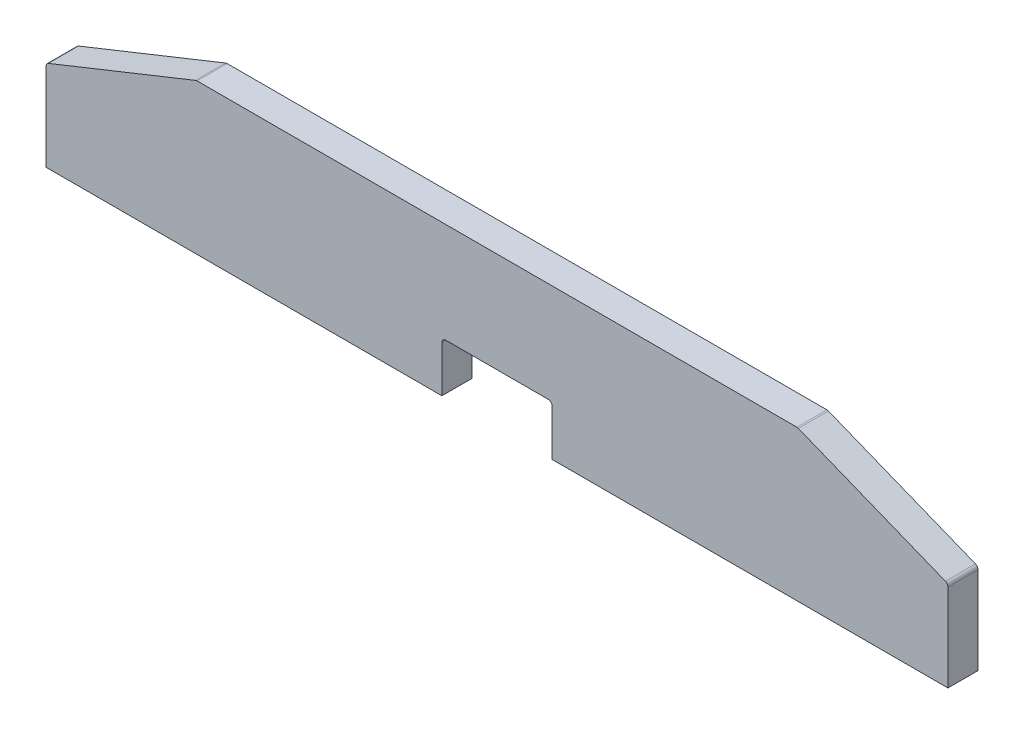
SolidWorks part; units mm, degrees
ref_plane "Piano frontale" through (0, 0, 0) normal (0, 0, 1) x (1, 0, 0)
ref_plane "Piano superiore" through (0, 0, 0) normal (0, 1, 0) x (1, 0, 0)
ref_plane "Piano destro" through (0, 0, 0) normal (1, 0, 0) x (0, 0, -1)
sketch "Schizzo1" plane through (0, 0, 0) normal (0, 0, 1) x (1, 0, 0)
  line L1 (-450, -50) -> (-55, -50)
  line L2 (-450, -50) -> (-450, 40)
  line L3 (-300, 100) -> (300, 100)
  line L4 (450, -50) -> (450, 40)
  line L7 (-450, -50) -> (-450, 40) construction
  line L8 (-450, 40) -> (-300, 100) construction
  line L9 (-450, 40) -> (-300, 100)
  line L10 (300, 100) -> (450, 40)
  line L12 (-55, -50) -> (-55, 0) construction
  line L13 (-55, 0) -> (55, 0) construction
  line L14 (-55, -50) -> (-55, 0)
  line L15 (-55, 0) -> (55, 0)
  line L16 (55, 0) -> (55, -50)
  line L17 (55, -50) -> (450, -50)
  point P0 (0, -50)
  dimension "D1" = 55
  dimension "D2" = 300
  dimension "D3" = 450
  dimension "D4" = 55
  dimension "D5" = 40
  dimension "D6" = 100
  dimension "D7" = 50
extrude "Estrusione-Estrusione1" add sketch "Schizzo1" along normal blind 30
fillet "Raccordo1" radius 4 1 edges at (55, 0, 15)
fillet "Raccordo2" radius 4 1 edges at (-55, 0, 15)
fillet "Raccordo3" radius 4 1 edges at (300, 100, 15)
fillet "Raccordo4" radius 4 1 edges at (450, 40, 15)
fillet "Raccordo5" radius 4 1 edges at (-300, 100, 15)
fillet "Raccordo6" radius 4 1 edges at (-450, 40, 15)
sketch "Sketch1" plane through (0, 0, 0) normal (0, 0, 1) x (1, 0, 0)
  line L0 (0, -10) -> (-300, -10) construction
  line L1 (-300, 52) -> (-300, 72)
  line L2 (-300, 72) -> (-280, 72)
  line L3 (-280, 72) -> (-280, 52)
  line L4 (-280, 52) -> (-300, 52)
  line L5 (-300, 10) -> (-300, -10)
  line L6 (-300, -10) -> (-280, -10)
  line L7 (-280, -10) -> (-280, 10)
  line L8 (-125, 52) -> (-125, 72)
  line L9 (280, 10) -> (300, 10)
  line L10 (105, 10) -> (125, 10)
  line L11 (105, -10) -> (105, 10)
  line L12 (125, -10) -> (105, -10)
  line L13 (125, 10) -> (125, -10)
  line L14 (105, 52) -> (125, 52)
  line L15 (105, 72) -> (105, 52)
  line L16 (125, 72) -> (105, 72)
  line L17 (125, 52) -> (125, 72)
  line L18 (0, 100) -> (0, -50) construction
  line L19 (280, -10) -> (280, 10)
  line L20 (0, -10) -> (300, -10) construction
  line L21 (-299.4129, 52) -> (299.4129, 52) construction
  line L22 (-125, 72) -> (-105, 72)
  line L23 (-105, 72) -> (-105, 52)
  line L24 (-105, 52) -> (-125, 52)
  line L25 (-125, 10) -> (-125, -10)
  line L26 (-125, -10) -> (-105, -10)
  line L27 (-105, -10) -> (-105, 10)
  line L28 (-105, 10) -> (-125, 10)
  line L29 (-280, 10) -> (-300, 10)
  line L30 (300, -10) -> (280, -10)
  line L31 (300, 10) -> (300, -10)
  line L32 (280, 52) -> (300, 52)
  line L33 (280, 72) -> (280, 52)
  line L34 (300, 72) -> (280, 72)
  line L35 (300, 52) -> (300, 72)
  line L37 (299.2297, 100) -> (-299.2297, 100) construction
  dimension "D2" = 62
  dimension "D3" = 20
  dimension "D4" = 10
  dimension "D5" = 62
  dimension "D6" = 20
  dimension "D7" = 20
  dimension "D8" = 20
  dimension "D9" = 20
  dimension "D10" = 20
  dimension "D11" = 20
  dimension "D12" = 20
  dimension "D13" = 105
  dimension "D14" = 300
extrude "Cut-Extrude1" cut sketch "Sketch1" along normal blind 20
